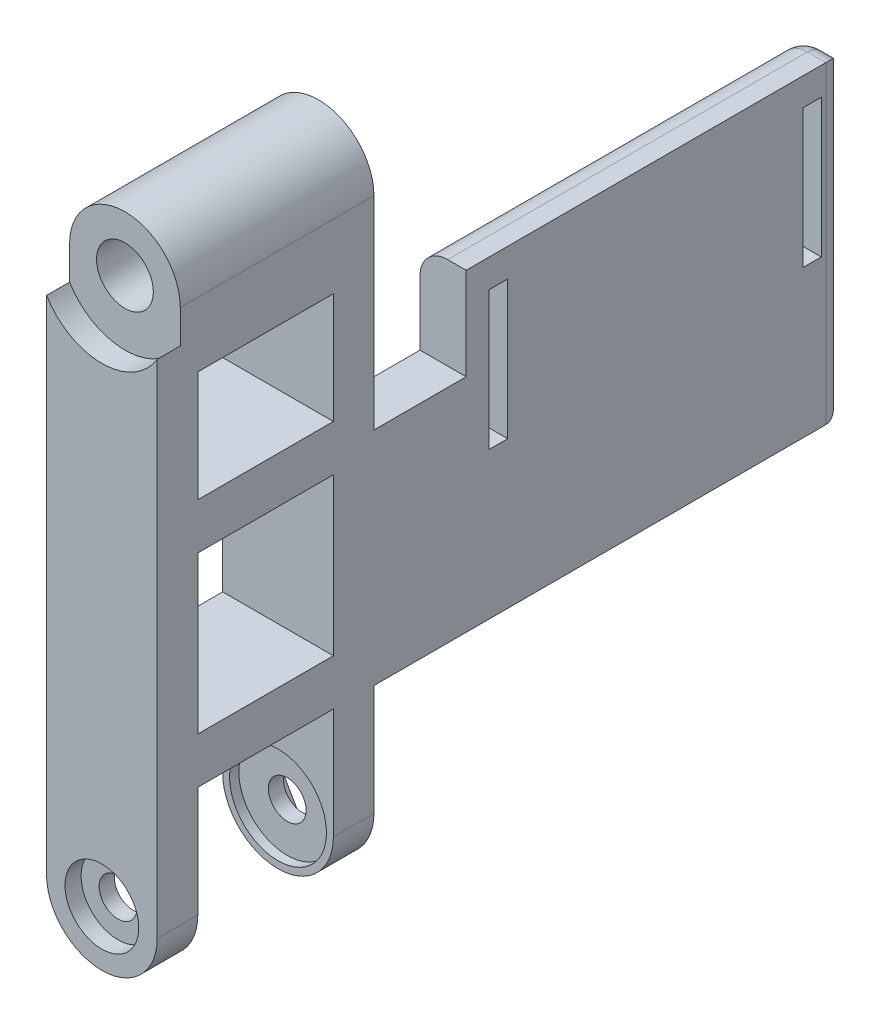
SolidWorks part; units mm, degrees
ref_plane "前视基准面" through (0, 0, 0) normal (0, 0, 1) x (1, 0, 0)
ref_plane "上视基准面" through (0, 0, 0) normal (0, 1, 0) x (1, 0, 0)
ref_plane "右视基准面" through (0, 0, 0) normal (1, 0, 0) x (0, 0, -1)
other "Configuration Table"
sketch "草图1" plane through (0, 0, 0) normal (0, 0, 1) x (1, 0, 0)
  line L2 (0, 0) -> (0, 58)
  line L4 (12, 0) -> (12, 58)
  arc A0 (0, 58) -> (12, 58) centre (6, 58) cw
  arc A1 (12, 0) -> (0, 0) centre (6, 0) cw
  circle A2 centre (6, 58) radius 3.08
  circle A3 centre (6, 0) radius 2.05
  dimension "D1" = 12
  dimension "D2" = 58
extrude "凸台-拉伸7" add sketch "草图1" against normal blind 25.5
sketch "草图6" plane through (12, 0, 0) normal (1, 0, 0) x (0, 0, -1)
  line L1 (5.4, -6) -> (20.1, -6)
  line L2 (5.4, -6) -> (5.4, 12)
  line L3 (5.4, 12) -> (20.1, 12)
  line L4 (20.1, -6) -> (20.1, 12)
  line L5 (0, 0) -> (0, -6) construction
  line L7 (5.4, 17) -> (20.1, 17)
  line L8 (5.4, 17) -> (5.4, 34)
  line L9 (5.4, 34) -> (20.1, 34)
  line L10 (20.1, 17) -> (20.1, 34)
  line L15 (5.4, 39) -> (20.1, 39)
  line L24 (5.4, 39) -> (5.4, 51)
  line L25 (5.4, 51) -> (20.1, 51)
  line L26 (20.1, 39) -> (20.1, 51)
  dimension "D6" = 12
  dimension "D1" = 14.7
  dimension "D2" = 5.4
  dimension "D3" = 5
  dimension "D4" = 5
  dimension "D5" = 17
extrude "切除-拉伸1" cut sketch "草图6" against normal blind 20
sketch "草图7" plane through (0, 0, 0) normal (0, 0, 1) x (1, 0, 0)
  circle A0 centre (6, 0) radius 3.15
extrude "切除-拉伸2" cut sketch "草图7" against normal blind 2.75
sketch "草图8" plane through (0, 0, -25.5) normal (0, 0, -1) x (-1, 0, 0)
  line L1 (-2.6514, 0) -> (-4.3257, 2.9)
  line L2 (-4.3257, 2.9) -> (-7.6743, 2.9)
  line L3 (-7.6743, 2.9) -> (-9.3486, 0)
  line L4 (-9.3486, 0) -> (-7.6743, -2.9)
  line L5 (-7.6743, -2.9) -> (-4.3257, -2.9)
  line L6 (-4.3257, -2.9) -> (-2.6514, 0)
  circle A0 centre (-6, 0) radius 2.9 construction
extrude "切除-拉伸3" cut sketch "草图8" against normal blind 2.75
sketch "草图9" plane through (0, 0, -25.5) normal (0, 0, -1) x (-1, 0, 0)
  line L5 (-12, 12) -> (-7, 12)
  line L6 (-12, 0) -> (-12, 58) construction
  line L7 (-12, 36) -> (-7, 36)
  line L8 (-12, 36) -> (-12, 12)
  line L10 (-7, 36) -> (-7, 12)
  circle A0 centre (-6, 0) radius 2.05 construction
  dimension "D1" = 12
  dimension "D2" = 24
  dimension "D3" = 5
extrude "凸台-拉伸8" add sketch "草图9" along normal blind 50
sketch "草图11" plane through (0, 0, 0) normal (0, 0, 1) x (1, 0, 0)
  circle A0 centre (6, 58) radius 7
extrude "切除-拉伸5" cut sketch "草图11" against normal blind 3.5
sketch "草图12" plane through (0, 0, -25.5) normal (0, 0, -1) x (-1, 0, 0)
  circle A0 centre (-6, 58) radius 7
extrude "切除-拉伸6" cut sketch "草图12" against normal blind 1
sketch "草图13" plane through (0, 0, 0) normal (0, 0, 1) x (1, 0, 0)
  line L0 (0, 0) -> (0, 54.3944)
  line L1 (12, 54.3944) -> (12, 0)
  arc A0 (0, 54.3944) -> (12, 54.3944) centre (6, 58) ccw
  arc A1 (0, 0) -> (12, 0) centre (6, 0) ccw
extrude "切除-拉伸7" cut sketch "草图13" against normal blind 1
sketch "草图14" plane through (0, 0, -25.5) normal (0, 0, -1) x (-1, 0, 0)
  line L0 (-12, 54.3944) -> (-12, 36)
  line L1 (-12, 36) -> (-7, 36)
  line L2 (-7, 36) -> (-7, 12)
  line L3 (-7, 12) -> (-12, 12)
  line L4 (-12, 12) -> (-12, 0)
  line L5 (0, 54.3944) -> (0, 0)
  arc A0 (-12, 54.3944) -> (0, 54.3944) centre (-6, 58) ccw
  arc A1 (-12, 0) -> (0, 0) centre (-6, 0) ccw
extrude "切除-拉伸8" cut sketch "草图14" against normal blind 1
sketch "草图15" plane through (0, 0, -5.4) normal (0, 0, -1) x (-1, 0, 0)
  circle A0 centre (-6, 0) radius 5.25
extrude "切除-拉伸9" cut sketch "草图15" against normal blind 1
sketch "草图16" plane through (0, 0, -20.1) normal (0, 0, 1) x (1, 0, 0)
  circle A0 centre (6, 0) radius 5.25
extrude "切除-拉伸10" cut sketch "草图16" against normal blind 1
fillet "圆角1" radius 3 1 edges at (7, 12, -50)
sketch "草图17" plane through (0, 36, 0) normal (0, 1, 0) x (1, 0, 0)
  line L0 (12, 75.5) -> (12, 24.5) construction
  line L1 (7, 75.5) -> (12, 75.5)
  line L2 (7, 75.5) -> (7, 34.5)
  line L3 (7, 34.5) -> (12, 34.5)
  line L4 (12, 75.5) -> (12, 34.5)
  line L5 (12, 24.5) -> (7, 24.5) construction
  dimension "D1" = 10
extrude "凸台-拉伸9" add sketch "草图17" along normal blind 10
sketch "草图10" plane through (12, 0, 0) normal (1, 0, 0) x (0, 0, -1)
  line L0 (75.5, 46) -> (75.5, 12) construction
  line L1 (37, 42.9325) -> (39, 42.9325)
  line L3 (37, 27.9325) -> (39, 27.9325)
  line L4 (39, 42.9325) -> (39, 27.9325)
  line L5 (71, 43) -> (73, 43)
  line L6 (71, 43) -> (71, 28)
  line L7 (71, 28) -> (73, 28)
  line L8 (73, 43) -> (73, 28)
  line L9 (37, 42.9325) -> (37, 27.9325)
  line L10 (34.5, 46) -> (75.5, 46) construction
  dimension "D1" = 2
  dimension "D2" = 2
  dimension "D3" = 2.5
  dimension "D4" = 32
  dimension "D5" = 3
  dimension "D7" = 15
extrude "切除-拉伸4" cut sketch "草图10" against normal blind 10
fillet "圆角2" radius 3 1 edges at (7, 46, -55)
fillet "圆角3" radius 2 6 edges at (11, 12, -75.5) (7.8787, 12.8787, -75.5) (11, 46, -75.5) (7.8787, 45.1213, -75.5) (12, 29, -75.5) (7, 29, -75.5)
sketch "草图18" plane through (0, 0, -1) normal (0, 0, 1) x (1, 0, 0)
  circle A0 centre (6, 0) radius 4
extrude "切除-拉伸11" cut sketch "草图18" against normal up to surface (1.75 mm away)
sketch "草图19" plane through (0, 0, -24.5) normal (0, 0, -1) x (-1, 0, 0)
  line L1 (-1.5, 0) -> (-3.75, 3.8971)
  line L2 (-3.75, 3.8971) -> (-8.25, 3.8971)
  line L3 (-8.25, 3.8971) -> (-10.5, 0)
  line L4 (-10.5, 0) -> (-8.25, -3.8971)
  line L5 (-8.25, -3.8971) -> (-3.75, -3.8971)
  line L6 (-3.75, -3.8971) -> (-1.5, 0)
  circle A0 centre (-6, 0) radius 3.8971 construction
  dimension "D1" = 4.5
extrude "切除-拉伸12" cut sketch "草图19" against normal up to surface (1.75 mm away)
